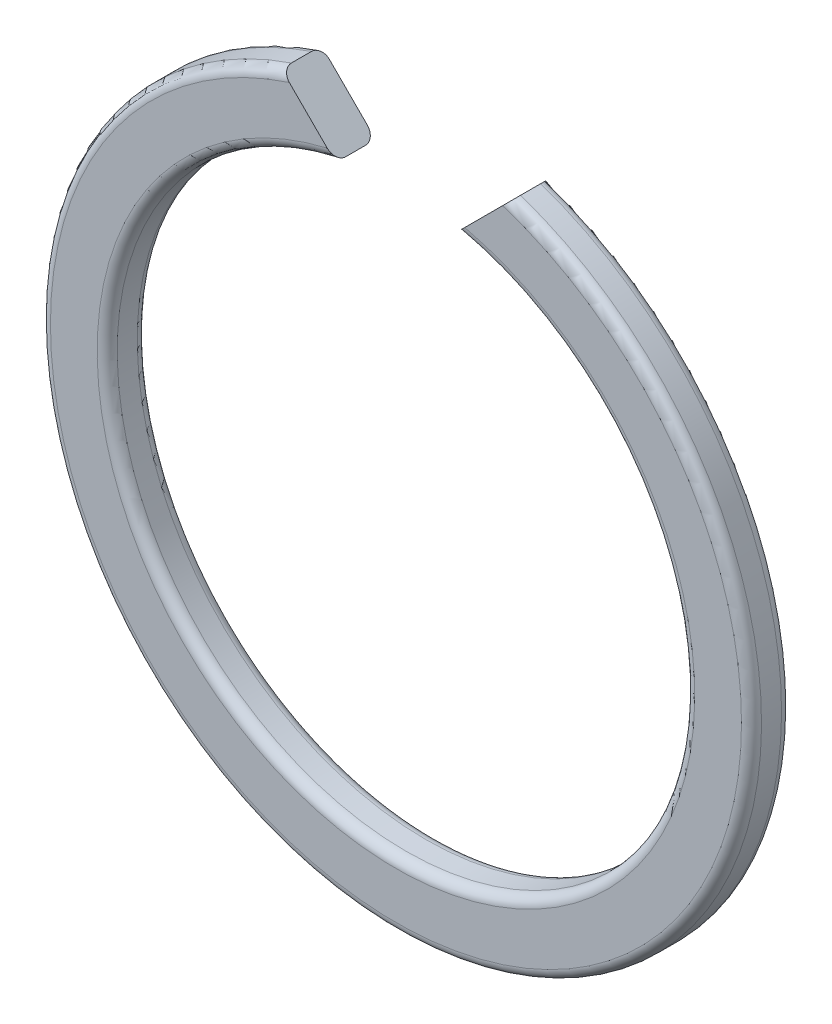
SolidWorks part; units mm, degrees
ref_plane "Front Plane" through (0, 0, 0) normal (0, 0, 1) x (1, 0, 0)
ref_plane "Top Plane" through (0, 0, 0) normal (0, 1, 0) x (1, 0, 0)
ref_plane "Right Plane" through (0, 0, 0) normal (1, 0, 0) x (0, 0, -1)
sketch "BodySke" plane through (0, 0, 0) normal (0, 0, 1) x (1, 0, 0)
  circle A0 centre (0, 0) radius 10.65
  circle A1 centre (0, 0) radius 8.65
  dimension "Groove_Diameter" = 21.3
  dimension "Groove_Width" = 2
extrude "BaseBody" add sketch "BodySke" along normal blind 1.2
sketch "SlitSke" plane through (0, 0, 0) normal (0, 0, 1) x (1, 0, 0)
  line L0 (0, 0) -> (0, 17.3673) construction
  line L1 (0, 6.65) -> (4, 10.65)
  line L2 (4, 10.65) -> (-4, 10.65)
  line L3 (0, 6.65) -> (-4, 10.65)
  circle A0 centre (0, 0) radius 10.65 construction
  point P9 (0, 9.3328)
  dimension "D1" = 90
  dimension "D2" = 6.65
extrude "Slit" cut sketch "SlitSke" along normal through all
fillet "Fillet1" radius 0.3 4 edges at (0, -8.65, 0) (0, -10.65, 0) (0, -10.65, 1.2) (0, -8.65, 1.2)
equation "\"D2@SlitSke\" = \"Groove_Diameter@BodySke\" / 2  -  \"Groove_Width@BodySke\" * 2"
